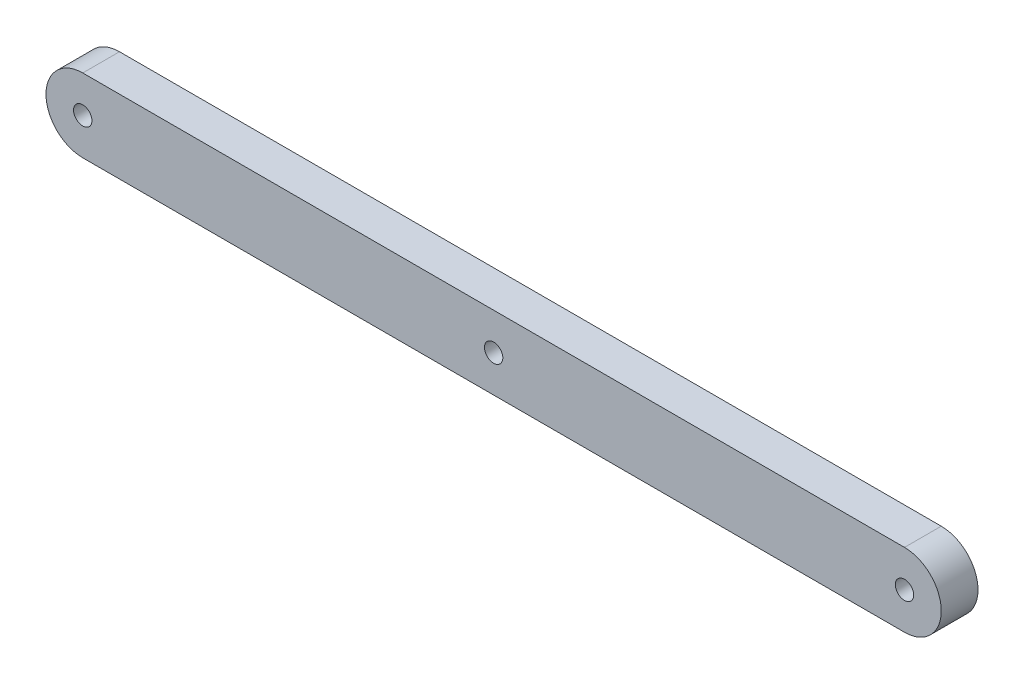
SolidWorks part; units mm, degrees
ref_plane "Front Plane" through (0, 0, 0) normal (0, 0, 1) x (1, 0, 0)
ref_plane "Top Plane" through (0, 0, 0) normal (0, 1, 0) x (1, 0, 0)
ref_plane "Right Plane" through (0, 0, 0) normal (1, 0, 0) x (0, 0, -1)
sketch "Sketch1" plane through (0, 0, 0) normal (0, 0, 1) x (1, 0, 0)
  line L0 (0, 0) -> (56.7944, 0) construction
  line L1 (0, 2.54) -> (56.7944, 2.54)
  line L2 (0, -2.54) -> (56.7944, -2.54)
  arc A0 (0, 2.54) -> (0, -2.54) centre (0, 0) ccw
  arc A1 (56.7944, -2.54) -> (56.7944, 2.54) centre (56.7944, 0) ccw
  point P3 (28.3972, 0)
  dimension "D1" = 2.54
  dimension "D2" = 56.7944
extrude "Boss-Extrude1" add sketch "Sketch1" along normal blind 2.54
sketch "Sketch2" plane through (0, 0, 2.54) normal (0, 0, 1) x (1, 0, 0)
  circle A0 centre (0, 0) radius 0.635
  dimension "D1" = 1.27
extrude "Cut-Extrude1" cut sketch "Sketch2" against normal through all both and the other way through all
ref_plane "Plane1" through (28.3972, 0, 0) normal (1, 0, 0) x (0, 0, -1)
mirror "Mirror1" about plane through (28.3972, 0, 0) normal (1, 0, 0) of "Cut-Extrude1"
sketch "Sketch3" plane through (0, 0, 2.54) normal (0, 0, 1) x (1, 0, 0)
  line L0 (56.7944, 2.54) -> (0, 2.54) construction
  circle A0 centre (28.3972, 0) radius 0.635
  dimension "D1" = 1.27
  dimension "D2" = 2.54
  dimension "D3" = 28.3972
extrude "Cut-Extrude2" cut sketch "Sketch3" against normal through all both and the other way through all
